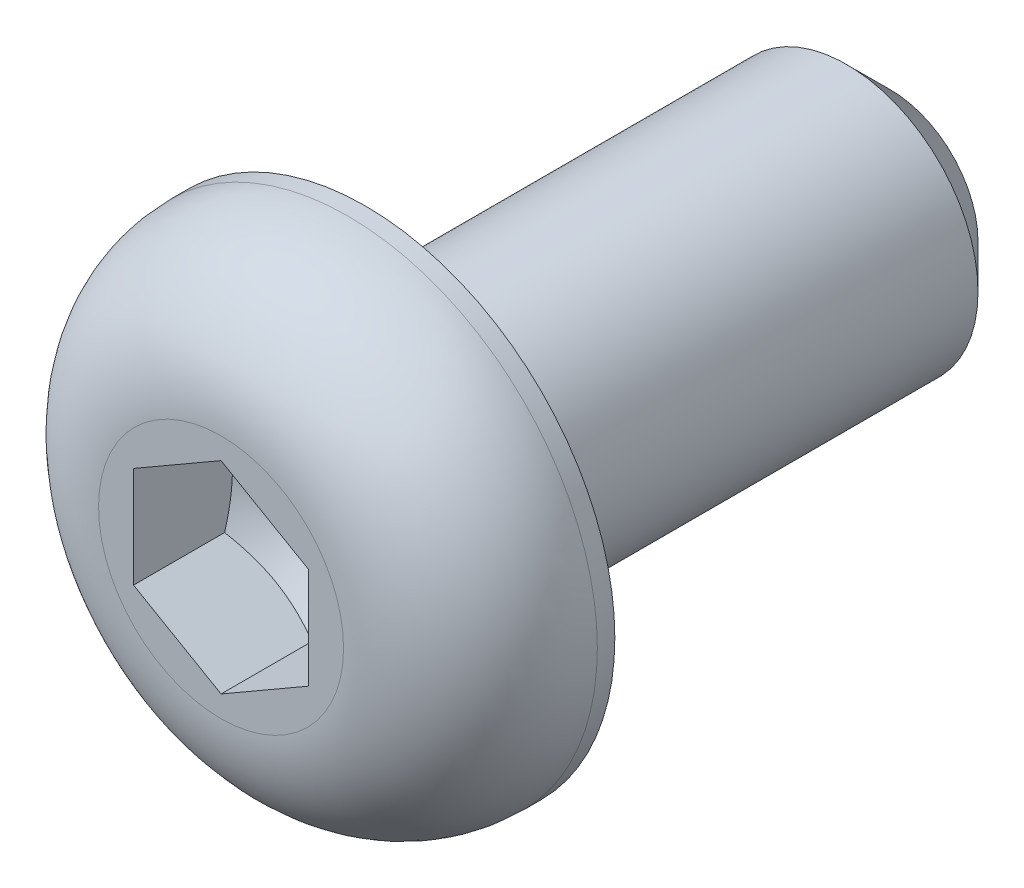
SolidWorks part; units mm, degrees
ref_plane "Спереди" through (0, 0, 0) normal (0, 0, 1) x (1, 0, 0)
ref_plane "Сверху" through (0, 0, 0) normal (0, 1, 0) x (1, 0, 0)
ref_plane "Справа" through (0, 0, 0) normal (1, 0, 0) x (0, 0, -1)
sketch "Sketch1" plane through (0, 0, 0) normal (1, 0, 0) x (0, 0, -1)
  line L0 (0, 0) -> (7.65, 0) construction
  line L1 (0, 0) -> (0, 2.85)
  line L2 (0, 2.85) -> (1.65, 2.85)
  line L3 (1.65, 2.85) -> (1.65, 1.5)
  line L4 (1.65, 1.5) -> (7.65, 1.5)
  line L5 (7.65, 1.5) -> (7.65, 0)
  line L6 (0, 0) -> (7.65, 0)
  line L7 (2.65, 1.5) -> (2.65, 0) construction
revolve "RevolveBase" add sketch "Sketch1" angle 360 about L0
fillet "FilletHead" radius 1.45 1 edges at (2.85, 0, 0)
chamfer "ChamferRod" distance 0.5 angle 45 1 edges at (1.5, 0, -7.65)
sketch "Sketch2" plane through (0, 0, 0) normal (0, 0, 1) x (1, 0, 0)
  line L1 (0, 1.1547) -> (-1, 0.5774)
  line L2 (-1, 0.5774) -> (-1, -0.5774)
  line L3 (-1, -0.5774) -> (0, -1.1547)
  line L4 (0, -1.1547) -> (1, -0.5774)
  line L5 (1, -0.5774) -> (1, 0.5774)
  line L6 (1, 0.5774) -> (0, 1.1547)
  circle A0 centre (0, 0) radius 1 construction
  circle A1 centre (0, 0) radius 1.15 construction
extrude "HexHead1" cut sketch "Sketch2" against normal blind 1.04
sketch "Sketch3" plane through (0, 0, -1.04) normal (0, 0, 1) x (1, 0, 0)
  line L1 (0, 1.1547) -> (-1, 0.5774)
  line L2 (-1, 0.5774) -> (-1, -0.5774)
  line L3 (-1, -0.5774) -> (0, -1.1547)
  line L4 (0, -1.1547) -> (1, -0.5774)
  line L5 (1, -0.5774) -> (1, 0.5774)
  line L6 (1, 0.5774) -> (0, 1.1547)
  circle A0 centre (0, 0) radius 1 construction
extrude "HexHeadD" cut sketch "Sketch3" against normal blind 1.4658
sketch "Sketch4" plane through (0, 0, 0) normal (1, 0, 0) x (0, 0, -1)
  line L0 (0, 0) -> (7.65, 0) construction
  line L1 (7.65, -1) -> (7.65, 1) construction
  line L2 (1.7072, 0) -> (1.7761, 0)
  line L3 (1.7761, 0) -> (1.7761, 1.1557)
  line L4 (1.7761, 1.1557) -> (1.04, 1.1557)
  line L5 (1.04, 1.1557) -> (1.7072, 0)
revolve "RevolveHexHeadD" add sketch "Sketch4" angle 360 about L0
fillet "Fillet1" radius 0.1 1 edges at (1.5, 0, -1.65)
equation "\"D1@Cosmetic Thread1\"=\"b@Sketch1\""
equation "\"D1@HexHeadD\" = \"e@Sketch2\" * tan ( 60 ) "
equation "\"D1@Sketch3\"=\"S@Sketch2\""
equation "\"D1@Sketch4\" = \"t@HexHead1\" + \"D1@HexHeadD\""
equation "\"D3@Sketch4\" = \"t@HexHead1\""
equation "\"D4@Sketch4\"=\"S@Sketch2\" * 1.1557"
